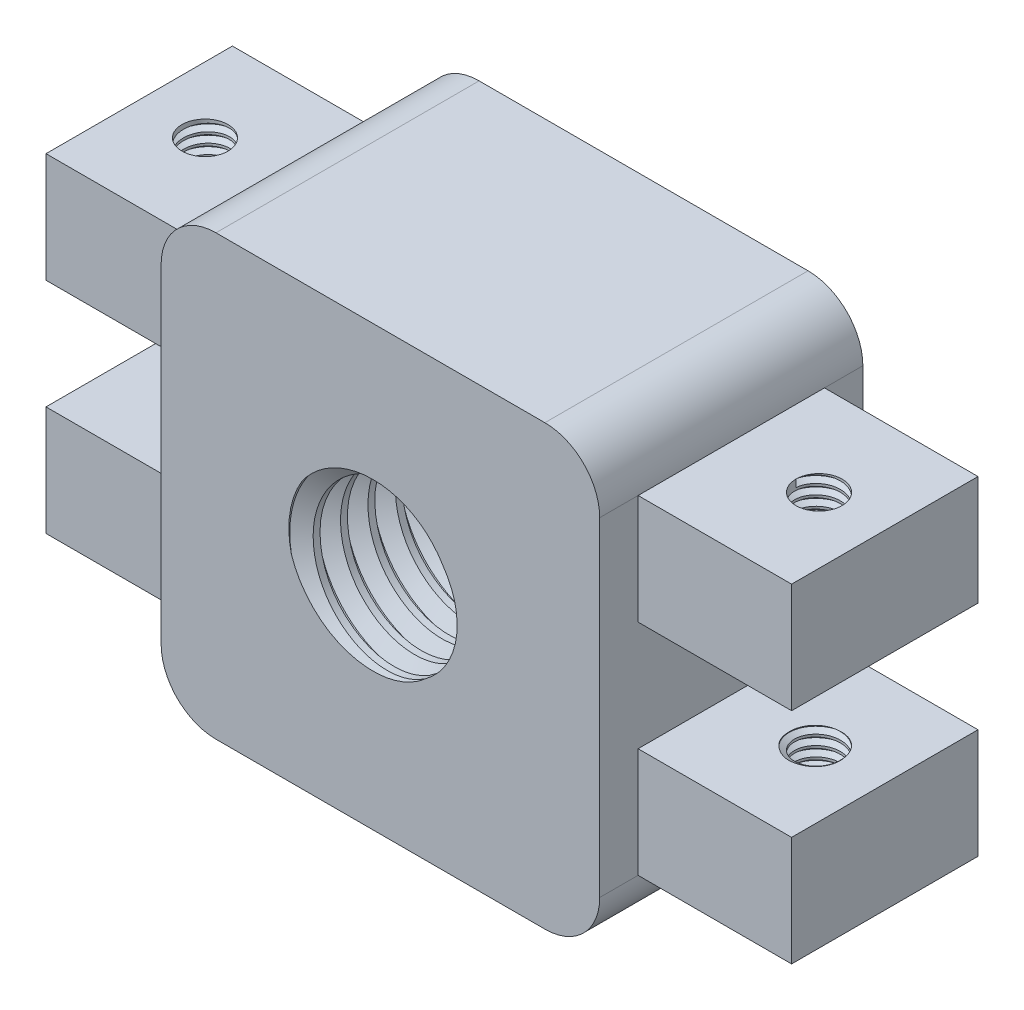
SolidWorks part; units mm, degrees
ref_plane "Ebene vorne" through (0, 0, 0) normal (0, 0, 1) x (1, 0, 0)
ref_plane "Ebene oben" through (0, 0, 0) normal (0, 1, 0) x (1, 0, 0)
ref_plane "Ebene rechts" through (0, 0, 0) normal (1, 0, 0) x (0, 0, -1)
sketch "Skizze2" plane through (0, 0, 0) normal (0, 0, 1) x (1, 0, 0)
  line L1 (-10, 10) -> (10, 10)
  line L2 (-10, 10) -> (-10, -10)
  line L3 (-10, -10) -> (10, -10)
  line L4 (10, 10) -> (10, -10)
  line L5 (-10, 10) -> (10, -10) construction
  line L6 (-10, -10) -> (10, 10) construction
  circle A0 centre (0, 0) radius 3.5
  point P0 (0, 0)
  dimension "D3" = 7
  dimension "D1" = 20
  dimension "D2" = 20
extrude "Aufsatz-Linear austragen1" add sketch "Skizze2" along normal blind 15
thread "Gewinde1" pitch 1.25 start angle 0, offset 0, length 19, pitch 1.25, diameter 7
ref_plane "Ebene1" through (-3.5, 0, 15) normal (0, -1, 0) x (-1, 0, 0)
sketch "Gewindeprofil1" plane through (-3.5, 0, 15) normal (0, -1, 0) x (-1, 0, 0)
  line L0 (0, 0) -> (0, 1.25) construction
  line L1 (0, 0) -> (0.6766, 0.3906)
  line L2 (0.6766, 0.3906) -> (0.6766, 0.5469)
  line L3 (0.6766, 0.5469) -> (0, 0.9375)
  line L4 (0.6766, 0.4687) -> (0, 0.4687) construction
  line L11 (0, 0) -> (0, 0.9375)
  point P2 (0, 0)
  dimension "Pitch" = 1.25
  dimension "Profile_Angle" = 60
  dimension "Profile_Land" = 0.1562
  dimension "Profile_Height" = 0.6766
sketch "Skizze6" plane through (0, 0, 15) normal (0, 0, 1) x (1, 0, 0)
  line L1 (-12.7044, 10.5824) -> (12.7044, 10.5824)
  line L2 (-12.7044, 10.5824) -> (-12.7044, -10.5824)
  line L3 (-12.7044, -10.5824) -> (12.7044, -10.5824)
  line L4 (12.7044, 10.5824) -> (12.7044, -10.5824)
  line L5 (-12.7044, 10.5824) -> (12.7044, -10.5824) construction
  line L6 (-12.7044, -10.5824) -> (12.7044, 10.5824) construction
  point P0 (0, 0)
extrude "Schnitt-Linear austragen1" cut sketch "Skizze6" against normal blind 3
ref_plane "Ebene4" through (0, 0, 0) normal (-1, 0, 0) x (0, 0, 1)
sketch "Skizze7" plane through (10, 0, 0) normal (1, 0, 0) x (0, 0, -1)
  line L0 (0, -10) -> (0, 10) construction
  line L1 (-10.25, 7.5) -> (-1.75, 7.5)
  line L2 (-10.25, 7.5) -> (-10.25, -7.5)
  line L3 (-10.25, -7.5) -> (-1.75, -7.5)
  line L4 (-1.75, 7.5) -> (-1.75, -7.5)
  line L5 (-10.25, 7.5) -> (-1.75, -7.5) construction
  line L6 (-10.25, -7.5) -> (-1.75, 7.5) construction
  point P0 (-6, 0)
  dimension "D1" = 6
  dimension "D2" = 15
  dimension "D3" = 8.5
extrude "Aufsatz-Linear austragen2" add sketch "Skizze7" along normal blind 7
sketch "Skizze8" plane through (17, 0, 0) normal (1, 0, 0) x (0, 0, -1)
  line L0 (-1.75, -7.5) -> (-1.75, 7.5) construction
  line L1 (-10.25, 2.5) -> (-1.75, 2.5)
  line L2 (-10.25, 2.5) -> (-10.25, -2.5)
  line L3 (-10.25, -2.5) -> (-1.75, -2.5)
  line L4 (-1.75, 2.5) -> (-1.75, -2.5)
  line L5 (-10.25, 2.5) -> (-1.75, -2.5) construction
  line L6 (-10.25, -2.5) -> (-1.75, 2.5) construction
  line L7 (0, -10) -> (0, 10) construction
  point P0 (-6, 0)
  dimension "D1" = 6
  dimension "D2" = 5
extrude "Schnitt-Linear austragen2" cut sketch "Skizze8" against normal blind 7
sketch "Skizze9" plane through (0, 7.5, 0) normal (0, 1, 0) x (1, 0, 0)
  line L0 (17, -10.25) -> (10, -10.25) construction
  line L1 (17, -1.75) -> (17, -10.25) construction
  circle A0 centre (14, -6) radius 1.05
  dimension "D3" = 2.1
  dimension "D1" = 4.25
  dimension "D2" = 3
extrude "Schnitt-Linear austragen3" cut sketch "Skizze9" against normal through all both and the other way through all
thread "Gewinde2" pitch 0.45 start angle 0, offset 0.0001, length 19, pitch 0.45, diameter 2.1
ref_plane "Ebene2" through (12.95, 7.4999, 6) normal (0, 0, 1) x (-1, 0, 0)
sketch "Gewindeprofil2" plane through (12.95, 7.4999, 6) normal (0, 0, 1) x (-1, 0, 0)
  line L0 (0, 0) -> (0, 0.45) construction
  line L1 (0, 0) -> (0.2436, 0.1406)
  line L2 (0.2436, 0.1406) -> (0.2436, 0.1969)
  line L3 (0.2436, 0.1969) -> (0, 0.3375)
  line L4 (0.2436, 0.1687) -> (0, 0.1687) construction
  line L11 (0, 0) -> (0, 0.3375)
  point P2 (0, 0)
  dimension "Pitch" = 0.45
  dimension "Profile_Angle" = 60
  dimension "Profile_Land" = 0.0562
  dimension "Profile_Height" = 0.2436
fillet "Verrundung1" radius 2.5 4 edges at (10, -10, 6) (-10, -10, 6) (10, 10, 6) (-10, 10, 6)
mirror "Spiegeln1" about plane through (0, 0, 0) normal (-1, 0, 0) of "Gewinde2", "Schnitt-Linear austragen3", "Schnitt-Linear austragen2", "Aufsatz-Linear austragen2"
